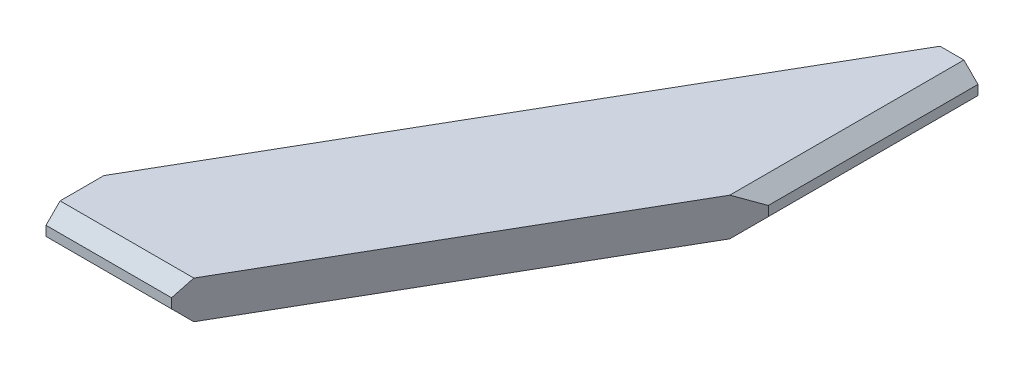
SolidWorks part; units mm, degrees
ref_plane "Front Plane" through (0, 0, 0) normal (1, 0, 0) x (0, 1, 0)
ref_plane "Top Plane" through (0, 0, 0) normal (0, 0, 1) x (0, 1, 0)
ref_plane "Right Plane" through (0, 0, 0) normal (0, 1, 0) x (-1, 0, 0)
sketch "sk w193" plane through (0, 0, 0) normal (0, 0, 1) x (0, 1, 0)
  point P0 (-399.034, -196.596)
  point P3 (-188.214, 0)
  line B0 (-399.034, -196.596) -> (-399.034, -160.02)
  line B1 (-399.034, -160.02) -> (-226.06, -160.02)
  line B2 (-210.82, -144.78) -> (-210.82, 144.78)
  line B3 (-226.06, 160.02) -> (-399.034, 160.02)
  line B4 (-399.034, 160.02) -> (-399.034, 196.596)
  line B5 (-399.034, 196.596) -> (0, 196.596)
  line B6 (0, 196.596) -> (0, 160.02)
  line B7 (0, 160.02) -> (-172.974, 160.02)
  line B8 (-188.214, 144.78) -> (-188.214, -144.78)
  line B9 (-172.974, -160.02) -> (0, -160.02)
  line B10 (0, -160.02) -> (0, -196.596)
  line B11 (0, -196.596) -> (-399.034, -196.596)
  arc B12 (-226.06, -160.02) -> (-210.82, -144.78) centre (-226.06, -144.78) ccw
  arc B13 (-210.82, 144.78) -> (-226.06, 160.02) centre (-226.06, 144.78) ccw
  arc B14 (-172.974, 160.02) -> (-188.214, 144.78) centre (-172.974, 144.78) ccw
  arc B15 (-188.214, -144.78) -> (-172.974, -160.02) centre (-172.974, -144.78) ccw
sketch_block_instance "w14x193-1-1"
sketch_block "w14x193-1" parameters "D4"=15.24, "D1"=399.034, "D2"=393.192, "D3"=22.606, "D5"=36.576
sketch "Sketch2" plane through (0, 0, 0) normal (0, 0, 1) x (0, 1, 0)
  line L0 (320, 501.4782) -> (320, -809.7231)
  line L1 (-188.214, 144.78) -> (-188.214, -144.78)
  line L2 (-188.214, -144.78) -> (-172.974, -160.02)
  line L3 (-172.974, -160.02) -> (5, -160.02)
  line L4 (-188.214, 144.78) -> (-172.974, 160.02)
  line L5 (-172.974, 160.02) -> (5, 160.02)
  line L6 (5, 201.596) -> (5, 160.02)
  line L7 (0, 196.596) -> (0, 160.02) construction
  line L8 (5, -160.02) -> (5, -201.596)
  line L9 (-285.82, 201.596) -> (5, 201.596)
  line L10 (-285.82, -201.596) -> (5, -201.596)
  line L11 (-285.82, 201.596) -> (-285.82, 239.696)
  line L12 (-285.82, 239.696) -> (167.6, 501.4782)
  line L13 (-285.82, -201.596) -> (-285.82, -239.696)
  line L14 (-285.82, -239.696) -> (167.6, -809.7231)
  line L15 (-210.82, -144.78) -> (-210.82, 144.78) construction
  line L16 (-399.034, 196.596) -> (0, 196.596) construction
  line L17 (0, -196.596) -> (-399.034, -196.596) construction
  line L18 (320, 501.4782) -> (167.6, 501.4782)
  line L19 (320, -809.7231) -> (167.6, -809.7231)
  point P30 (320, 501.4782)
  point P31 (320, -809.7231)
  dimension "D1" = 320
  dimension "D2" = 5
  dimension "D3" = 75
  dimension "D4" = 5
  dimension "D5" = 5
  dimension "D6" = 30
  dimension "D7" = 51.5
  dimension "D8" = 38.1
  dimension "D9" = 38.1
  dimension "D10" = 152.4
sketch "Sketch3" plane through (0, 0, 0) normal (0, 1, 0) x (-1, 0, 0)
  line L5 (63.0163, 236.1473) -> (178.8352, 236.1473)
  line L10 (178.8352, 236.1473) -> (178.8352, 182.7517)
  line L11 (178.8352, 182.7517) -> (-103.4257, -306.1387)
  line L12 (-103.4257, -306.1387) -> (-138.4257, -306.1387)
  line L13 (-138.4257, -306.1387) -> (-138.4257, -112.7604)
  line L14 (63.0163, 236.1473) -> (-138.4257, -112.7604)
  line L15 (-37.7047, 61.6935) -> (37.7047, -61.6935) construction
  point P8 (0, 0)
  dimension "D1" = 35
  dimension "D2" = 127
  dimension "D3" = 115.819
  dimension "D5" = 60
  dimension "D6" = 542.286
extrude "Boss-Extrude1" add sketch "Sketch3" along normal mid plane 34.925
chamfer "Chamfer1" distance 13 angle 45 4 edges at (138.4257, -17.4625, -209.4495) (-120.9257, -17.4625, 236.1473) (138.4257, 17.4625, -209.4495) (-120.9257, 17.4625, 236.1473)
